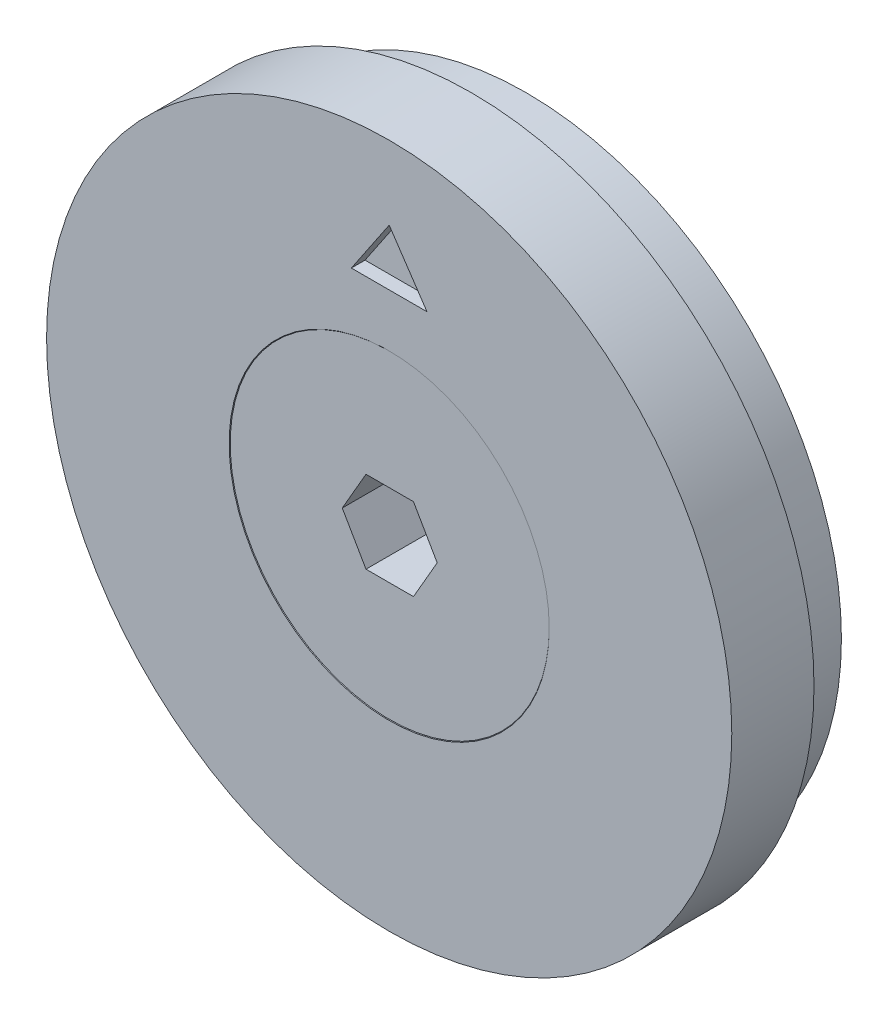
SolidWorks part; units mm, degrees
other "<M5 X .8 FHCS>-<Imported1>"
ref_plane "Front Plane" through (0, 0, 0) normal (0, 0, 1) x (1, 0, 0)
ref_plane "Top Plane" through (0, 0, 0) normal (0, 1, 0) x (1, 0, 0)
ref_plane "Right Plane" through (0, 0, 0) normal (1, 0, 0) x (0, 0, -1)
imported_body "Imported1"
inserted part "M5 X .8 FHCS"
move or copy body "Body-Move/Copy2" placed by mates yes
